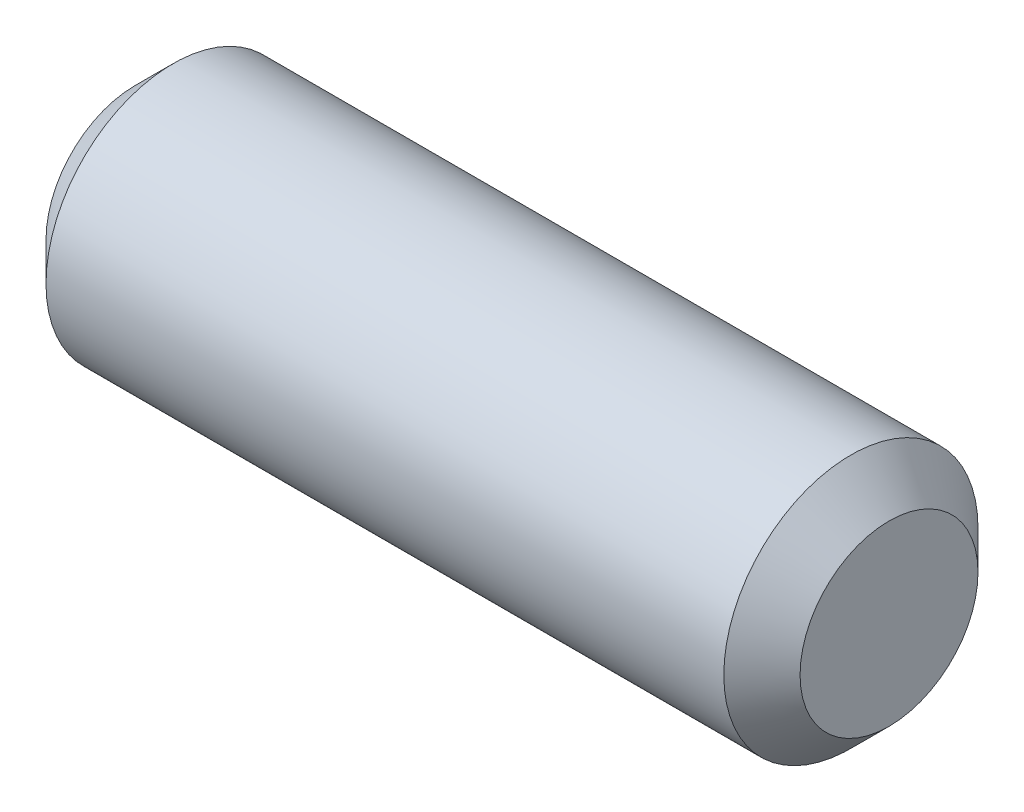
SolidWorks part; units mm, degrees
ref_plane "Ebene vorne" through (0, 0, 0) normal (0, 0, 1) x (1, 0, 0)
ref_plane "Ebene oben" through (0, 0, 0) normal (0, 1, 0) x (1, 0, 0)
ref_plane "Ebene rechts" through (0, 0, 0) normal (1, 0, 0) x (0, 0, -1)
sketch "Skizze2" plane through (0, 0, 0) normal (0, 0, 1) x (1, 0, 0)
  line L0 (-8.9, 0) -> (-8.9, 2.1)
  line L1 (-8.9, 2.1) -> (-8, 3)
  line L2 (-8, 3) -> (8, 3)
  line L3 (8, 3) -> (8.9, 2.1)
  line L4 (8.9, 2.1) -> (8.9, 0)
  line L5 (8.9, 0) -> (-8.9, 0)
  line L6 (-15.4571, 0) -> (14.369, 0) construction
  line L7 (0, 4.2174) -> (0, -3.4928) construction
  dimension "D1" = 6
  dimension "D2" = 45
  dimension "D3" = 0.9
  dimension "D4" = 16
revolve "Rotation1" add sketch "Skizze2" angle 360 about L6
